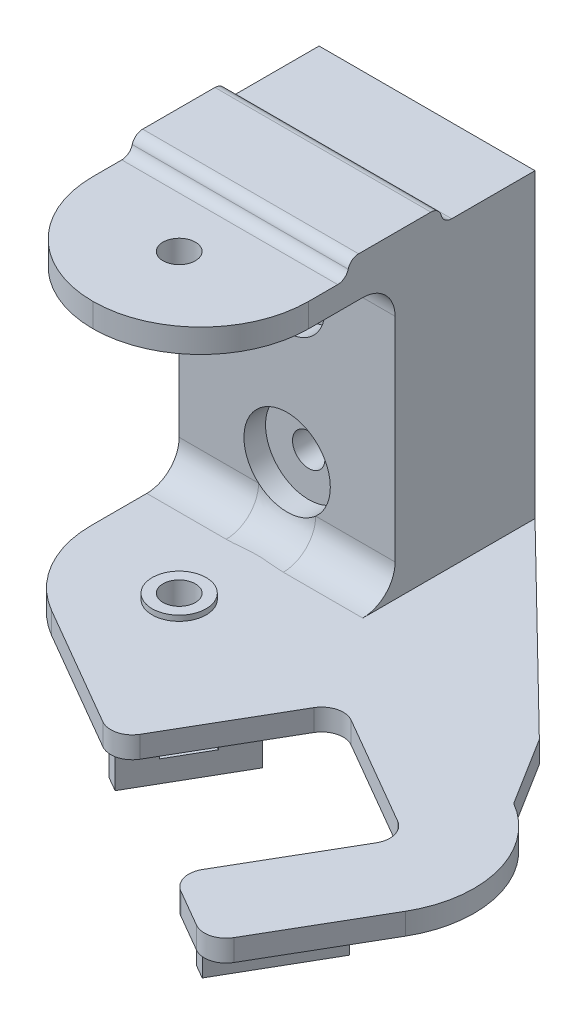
SolidWorks part; units mm, degrees
ref_plane "Plan de face" through (0, 0, 0) normal (0, 0, 1) x (1, 0, 0)
ref_plane "Plan de dessus" through (0, 0, 0) normal (0, 1, 0) x (1, 0, 0)
ref_plane "Plan de droite" through (0, 0, 0) normal (1, 0, 0) x (0, 0, -1)
sketch "Esquisse1" plane through (0, 0, 0) normal (1, 0, 0) x (0, 0, -1)
  line L1 (0, 15.4092) -> (-30.959, 15.4092)
  line L2 (0, 15.4092) -> (0, -12.5908)
  line L3 (0, -12.5908) -> (-30.959, -12.5908)
  line L4 (-30.959, 15.4092) -> (-30.959, -12.5908)
  dimension "D1" = 28
extrude "Boss.-Extru.1" add sketch "Esquisse1" along normal mid plane 20
sketch "Esquisse2" plane through (0, 0, 0) normal (1, 0, 0) x (0, 0, -1)
  line L1 (-12.9594, 13.2092) -> (-30.959, 13.2092)
  line L2 (-12.9594, 13.2092) -> (-12.9594, -12.5908)
  line L3 (-12.9594, -12.5908) -> (-30.959, -12.5908)
  line L4 (-30.959, 13.2092) -> (-30.959, -12.5908)
  dimension "D1" = 25.8
extrude "Enlèv. mat.-Extru.1" cut sketch "Esquisse2" against normal mid plane 20
ref_plane "Plan1" through (0, -12.5, 0) normal (0, 1, 0) x (1, 0, 0)
sketch "Esquisse3" plane through (0, -12.5, 0) normal (0, 1, 0) x (1, 0, 0)
  line L0 (15.7454, -51.6239) -> (31.8599, -23.8323)
  line L1 (31.8599, -23.8323) -> (27.9157, -17.514)
  line L2 (27.9157, -17.514) -> (10, 0)
  line L3 (10, 0) -> (-10, 0)
  line L4 (10, 0) -> (-10, 0) construction
  line L5 (-10, 0) -> (-10, -30.959)
  line L6 (-10, -12.9594) -> (-10, -30.959) construction
  line L7 (10, -30.959) -> (-10, -30.959) construction
  line L8 (-10, -30.959) -> (-3.3016, -40.6609)
  line L9 (-3.3016, -40.6609) -> (15.7454, -51.6239)
extrude "Boss.-Extru.2" add sketch "Esquisse3" against normal blind 2
sketch "Esquisse4" plane through (0, 15.4092, 0) normal (0, 1, 0) x (1, 0, 0)
  line L0 (10, -30.959) -> (-10, -30.959) construction
  line L1 (10, 0) -> (10, -30.959) construction
  circle A0 centre (0, -22.959) radius 1.5
  dimension "D1" = 8
  dimension "D2" = 10
  dimension "D3" = 3
extrude "Enlèv. mat.-Extru.2" cut sketch "Esquisse4" against normal through all both and the other way through all
sketch "Esquisse5" plane through (0, 13.2092, 0) normal (0, -1, 0) x (1, 0, 0)
  circle A0 centre (0, 22.959) radius 2.5
  circle A1 centre (0, 22.959) radius 1.5
  dimension "D1" = 5
extrude "Boss.-Extru.3" add sketch "Esquisse5" along normal blind 0.5
sketch "Esquisse7" plane through (0, -14.5, 0) normal (0, -1, 0) x (-1, 0, 0)
  line L0 (-15.7454, -51.6239) -> (-31.8599, -23.8323)
  line L1 (-31.8599, -23.8323) -> (-40.5108, -28.8484)
  line L2 (-40.5108, -28.8484) -> (-24.3963, -56.64)
  line L3 (-24.3963, -56.64) -> (-15.7454, -51.6239)
  dimension "D1" = 10
extrude "Boss.-Extru.4" add sketch "Esquisse7" against normal blind 2
sketch "Esquisse9" plane through (0, 0, 0) normal (0, 0, -1) x (-1, 0, 0)
  line L0 (-10, 15.4092) -> (10, 15.4092) construction
  line L1 (-8, 13.4092) -> (8, 13.4092)
  line L2 (-8, 13.4092) -> (-8, -12.5)
  line L3 (-8, -12.5) -> (8, -12.5)
  line L4 (8, 13.4092) -> (8, -12.5)
  line L5 (-10, -12.5) -> (-10, 15.4092) construction
  line L6 (10, -14.5) -> (10, 15.4092) construction
  line L7 (11, -12.5) -> (-11, -12.5) construction
  dimension "D1" = 2
  dimension "D2" = 2
  dimension "D3" = 2
extrude "Enlèv. mat.-Extru.4" cut sketch "Esquisse9" against normal blind 9
sketch "Esquisse10" plane through (0, 0, 9) normal (0, 0, -1) x (-1, 0, 0)
  line L0 (0, 13.4092) -> (0, -12.5) construction
  line L1 (8, 13.4092) -> (-8, 13.4092) construction
  line L2 (11, -12.5) -> (-11, -12.5) construction
  line L3 (-8, 0.4546) -> (23.6217, 0.4546) construction
  line L4 (-8, 13.4092) -> (-8, -12.5) construction
  line L5 (8, 13.4092) -> (-8, 13.4092) construction
  circle A0 centre (0, 7.4092) radius 1.5
  circle A1 centre (0, -6.5) radius 1.5
  dimension "D1" = 3
  dimension "D2" = 6
extrude "Enlèv. mat.-Extru.5" cut sketch "Esquisse10" against normal blind 15
sketch "Esquisse11" plane through (0, 0, 12.9594) normal (0, 0, 1) x (1, 0, 0)
  circle A0 centre (0, -6.5) radius 4
  circle A1 centre (0, 7.4092) radius 3.5
  dimension "D1" = 8
  dimension "D2" = 7
extrude "Enlèv. mat.-Extru.6" cut sketch "Esquisse11" against normal blind 2
sketch "Esquisse12" plane through (0, -12.5, 0) normal (0, 1, 0) x (1, 0, 0)
  circle A0 centre (0, -22.959) radius 2.5
  circle A1 centre (0, -22.959) radius 1.5
extrude "Boss.-Extru.5" add sketch "Esquisse12" along normal blind 0.5
sketch "Esquisse8" plane through (0, -14.5, 0) normal (0, -1, 0) x (-1, 0, 0)
  line L0 (-40.5108, -28.8484) -> (-24.3963, -56.64) construction
  line L1 (-24.3963, -56.64) -> (-15.7454, -51.6239) construction
  line L2 (3.3016, -40.6609) -> (-15.7454, -51.6239) construction
  circle A46 centre (-27.2454, -41.5308) radius 1 construction
  circle A57 centre (-20.4997, -49.0504) radius 0.9939
  circle A119 centre (-8.8794, -30.9417) radius 1 construction
  dimension "D1" = 26.3142
  dimension "D2" = 21.2001
  dimension "D4" = 14.5
  dimension "D3" = 14.5
extrude "Enlèv. mat.-Extru.3" cut sketch "Esquisse8" against normal blind 5
sketch "Esquisse13" plane through (0, -14.5, 0) normal (0, -1, 0) x (1, 0, 0)
  line L0 (26.1946, 61.811) -> (32.2497, 51.3681)
  line L1 (32.2497, 51.3681) -> (-11.853, 25.796)
  line L2 (-11.853, 25.796) -> (-22.1701, 51.0117)
  line L3 (-22.1701, 51.0117) -> (26.1946, 61.811)
  line L4 (40.5108, 28.8484) -> (24.3963, 56.64) construction
extrude "Enlèv. mat.-Extru.7" cut sketch "Esquisse13" against normal blind 10
fillet "Congé1" radius 10 1 edges at (40.5108, -13.5, 28.8484)
sketch "Esquisse14" plane through (0, -12.5, 0) normal (0, 1, 0) x (1, 0, 0)
  line L0 (11.3768, -26.6101) -> (6.3819, -35.2733)
  line L1 (6.3819, -35.2733) -> (5.0825, -34.524)
  line L2 (5.0825, -34.524) -> (10.0773, -25.8608)
  line L3 (10.0773, -25.8608) -> (11.3768, -26.6101)
  line L4 (17.7592, -36.0614) -> (21.7954, -29.0609) construction
  line L5 (26.639, -41.1812) -> (8.8794, -30.9417) construction
  line L6 (8.8794, -30.9417) -> (17.5042, -15.9826) construction
  line L7 (30.4359, -37.5988) -> (29.1364, -36.8496)
  line L8 (25.441, -46.262) -> (30.4359, -37.5988)
  line L9 (24.1415, -45.5128) -> (25.441, -46.262)
  line L10 (29.1364, -36.8496) -> (24.1415, -45.5128)
  dimension "D1" = 5
  dimension "D2" = 5
  dimension "D3" = 1.5
  dimension "D4" = 20.5
extrude "Boss.-Extru.6" add sketch "Esquisse14" against normal blind 6
sketch "Esquisse15" plane through (39.1121, 0, 22.5506) normal (0.8663, 0, 0.4995) x (0.4995, 0, -0.8663)
  line L1 (-24.3703, -14.5) -> (-20.3703, -14.5)
  line L2 (-24.3703, -14.5) -> (-24.3703, -16.5)
  line L3 (-24.3703, -16.5) -> (-20.3703, -16.5)
  line L4 (-20.3703, -14.5) -> (-20.3703, -16.5)
  line L5 (-27.3703, -18.5) -> (-27.3703, -14.5) construction
  line L7 (-27.3703, -18.5) -> (-17.3703, -18.5) construction
  dimension "D1" = 2
  dimension "D2" = 4
  dimension "D3" = 3
  dimension "D4" = 2
extrude "Enlèv. mat.-Extru.8" cut sketch "Esquisse15" against normal through all both and the other way through all
fillet "Congé3" radius 10 3 edges at (-10, -13.5, 26.8704) (10, 14.3092, 30.959) (-10, 14.3092, 30.959)
sketch "Esquisse16" plane through (0, -14.5, 0) normal (0, -1, 0) x (-1, 0, 0)
  line L1 (-8.0128, -37.3148) -> (-21.7448, -45.2771)
  line L2 (-8.0128, -37.3148) -> (-15.9204, -23.6771)
  line L3 (-15.9204, -23.6771) -> (-29.6524, -31.6394)
  line L4 (-21.7448, -45.2771) -> (-29.6524, -31.6394)
  line L7 (-35.4947, -37.4994) -> (-28.66, -49.2867) construction
  line L9 (5.0161, -29.7602) -> (-28.66, -49.2867) construction
  line L10 (-9.8784, -29.209) -> (-27.6379, -39.4485) construction
  dimension "D1" = 15.7644
extrude "Enlèv. mat.-Extru.9" cut sketch "Esquisse16" against normal blind 6
fillet "Congé4" radius 2 5 edges at (28.66, -13.5, 49.2867) (21.7448, -13.5, 45.2771) (8.0128, -13.5, 37.3148) (15.9204, -13.5, 23.6771) (29.6524, -13.5, 31.6394)
fillet "Congé5" radius 3 2 edges at (0, -12.5, 12.9594) (0, 13.2092, 12.9594)
sketch "Esquisse17" plane through (0, 15.4092, 0) normal (0, 1, 0) x (1, 0, 0)
  line L0 (10, 0) -> (10, -20.959) construction
  line L1 (-10, -8.7129) -> (10, -8.7129)
  line L2 (-10, -8.7129) -> (-10, -17.2737)
  line L3 (-10, -17.2737) -> (10, -17.2737)
  line L4 (10, -8.7129) -> (10, -17.2737)
  line L5 (-10, 0) -> (-10, -20.959) construction
extrude "Boss.-Extru.7" add sketch "Esquisse17" along normal blind 1.5
fillet "Congé6" radius 1 2 edges at (0, 15.4092, 17.2737) (0, 15.4092, 8.7129)
fillet "Congé7" radius 1 2 edges at (0, 16.9092, 8.7129) (0, 16.9092, 17.2737)
